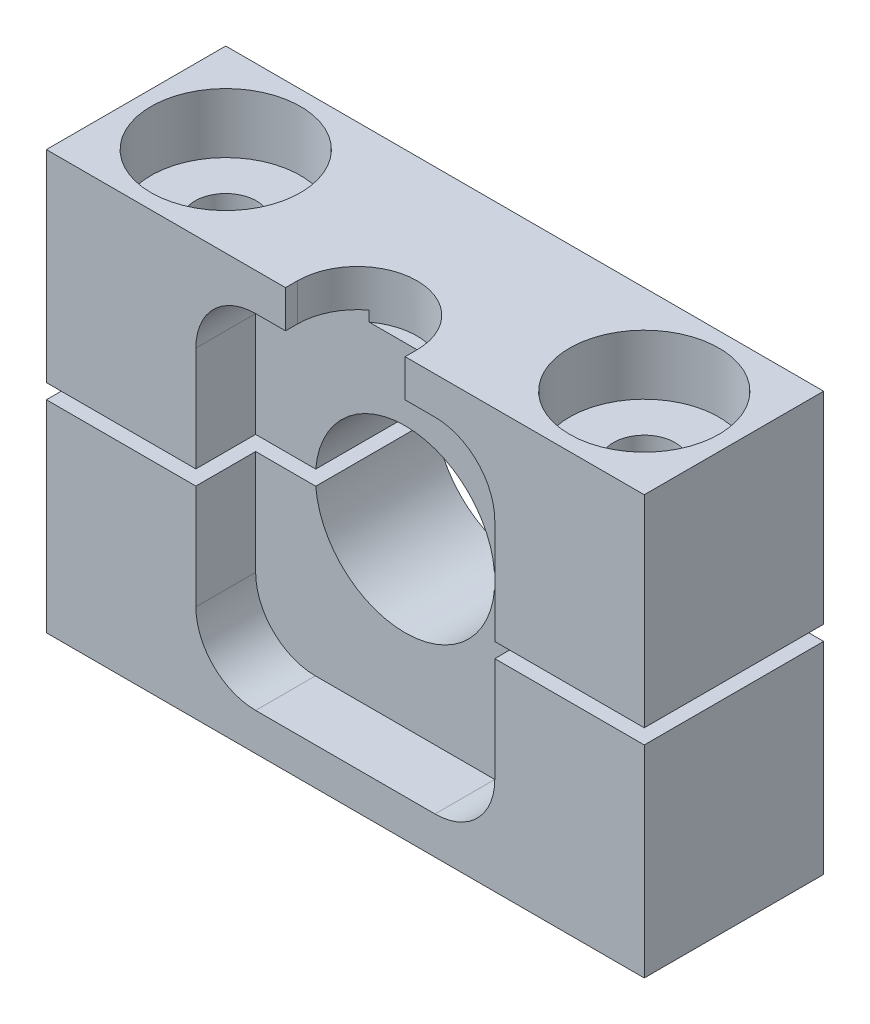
SolidWorks part; units mm, degrees
ref_plane "Front" through (0, 0, 0) normal (0, 0, 1) x (1, 0, 0)
ref_plane "Top" through (0, 0, 0) normal (0, 1, 0) x (1, 0, 0)
ref_plane "Right" through (0, 0, 0) normal (1, 0, 0) x (0, 0, -1)
sketch "Sketch1" plane through (0, 0, 0) normal (0, 0, 1) x (1, 0, 0)
  line L0 (31.75, 22.225) -> (-31.75, 22.225)
  line L1 (-31.75, 22.225) -> (-31.75, -22.225)
  line L2 (-31.75, -22.225) -> (0, -22.225)
  line L3 (0, 22.225) -> (0, -29.6308) construction
  line L6 (31.75, -22.225) -> (0, -22.225)
  line L7 (31.75, 22.225) -> (31.75, -22.225)
  circle A0 centre (0, 0) radius 9.525
  dimension "D1" = 9.525
  dimension "D2" = 44.45
  dimension "D3" = 22.225
  dimension "D4" = 63.5
extrude "Boss-Extrude1" add sketch "Sketch1" along normal mid plane 19.05
sketch "Sketch2" plane through (0, 0, 9.525) normal (0, 0, 1) x (1, 0, 0)
  line L1 (-9.525, 18.2499) -> (9.525, 18.2499)
  line L2 (-15.875, 11.8999) -> (-15.875, -11.8999)
  line L3 (-9.525, -18.2499) -> (9.525, -18.2499)
  line L4 (15.875, 11.8999) -> (15.875, -11.8999)
  arc A0 (-9.525, 18.2499) -> (-15.875, 11.8999) centre (-9.525, 11.8999) ccw
  arc A1 (9.525, 18.2499) -> (15.875, 11.8999) centre (9.525, 11.8999) cw
  arc A2 (9.525, -18.2499) -> (15.875, -11.8999) centre (9.525, -11.8999) ccw
  arc A3 (-15.875, -11.8999) -> (-9.525, -18.2499) centre (-9.525, -11.8999) ccw
  point P5 (-15.875, 0)
  point P8 (0, 18.2499)
  point P10 (-15.875, 18.2499)
  point P13 (15.875, 18.2499)
  point P18 (-15.875, -18.2499)
  dimension "D3" = 6.35
  dimension "D1" = 31.75
  dimension "D2" = 36.4998
sketch "Sketch5" plane through (0, 0, 9.525) normal (0, 0, 1) x (1, 0, 0)
  circle A0 centre (0, 0) radius 19.05
  dimension "D1" = 38.1
hole_wizard "CBORE for 1/4 Socket Head Cap Screw1" positions "Sketch3" profile "Sketch4" counterbore size "1/4" standard "ANSI Inch"
sketch "Sketch3" plane through (0, 22.225, 0) normal (0, 1, 0) x (1, 0, 0)
  point P0 (-22.225, 0)
  point P2 (22.225, 0)
  dimension "D1" = 44.45
  dimension "D2" = 22.225
sketch "Sketch4" plane through (-22.225, 22.225, 0) normal (1, 0, 0) x (0, 0, 1)
  line L0 (0, 0) -> (0, 44.45)
  line L1 (0, 44.45) -> (3.2639, 44.45)
  line L3 (3.2639, 44.45) -> (3.2639, 6.35)
  line L4 (3.2639, 6.35) -> (7.9375, 6.35)
  line L5 (7.9375, 6.35) -> (7.9375, 0)
  line L7 (7.9375, 0) -> (0, 0)
  line L11 (0, -6.35) -> (0, 107.95) construction
  dimension "Thru Hole Dia." = 6.5278
  dimension "Thru Hole Depth" = 44.45
  dimension "C'Bore Dia." = 15.875
  dimension "C'Bore Depth" = 6.35
extrude "Cut-Extrude1" [suppressed] cut sketch "Sketch5" against normal blind 6.35
extrude "Cut-Extrude2" cut sketch "Sketch2" against normal blind 6.35
sketch "Sketch6" plane through (0, 0, 0) normal (0, 1, 0) x (1, 0, 0)
  line L1 (31.75, 9.525) -> (-31.75, 9.525)
  line L2 (31.75, 9.525) -> (31.75, -9.525)
  line L3 (31.75, -9.525) -> (-31.75, -9.525)
  line L4 (-31.75, 9.525) -> (-31.75, -9.525)
extrude "Cut-Extrude3" cut sketch "Sketch6" against normal mid plane 1.5748
sketch "Sketch7" plane through (0, 22.225, 0) normal (0, 1, 0) x (1, 0, 0)
  line L0 (0, -8.255) -> (0, -18.5267) construction
  line L1 (6.35, -8.255) -> (6.35, -18.5267)
  line L2 (-6.35, -8.255) -> (-6.35, -18.5267)
  line L3 (31.75, -9.525) -> (-31.75, -9.525) construction
  arc A0 (6.35, -8.255) -> (-6.35, -8.255) centre (0, -8.255) ccw
  arc A1 (-6.35, -18.5267) -> (6.35, -18.5267) centre (0, -18.5267) ccw
  point P3 (0, -13.3908)
  dimension "D1" = 6.35
  dimension "D2" = 1.27
extrude "Cut-Extrude4" cut sketch "Sketch7" against normal blind 5.08
